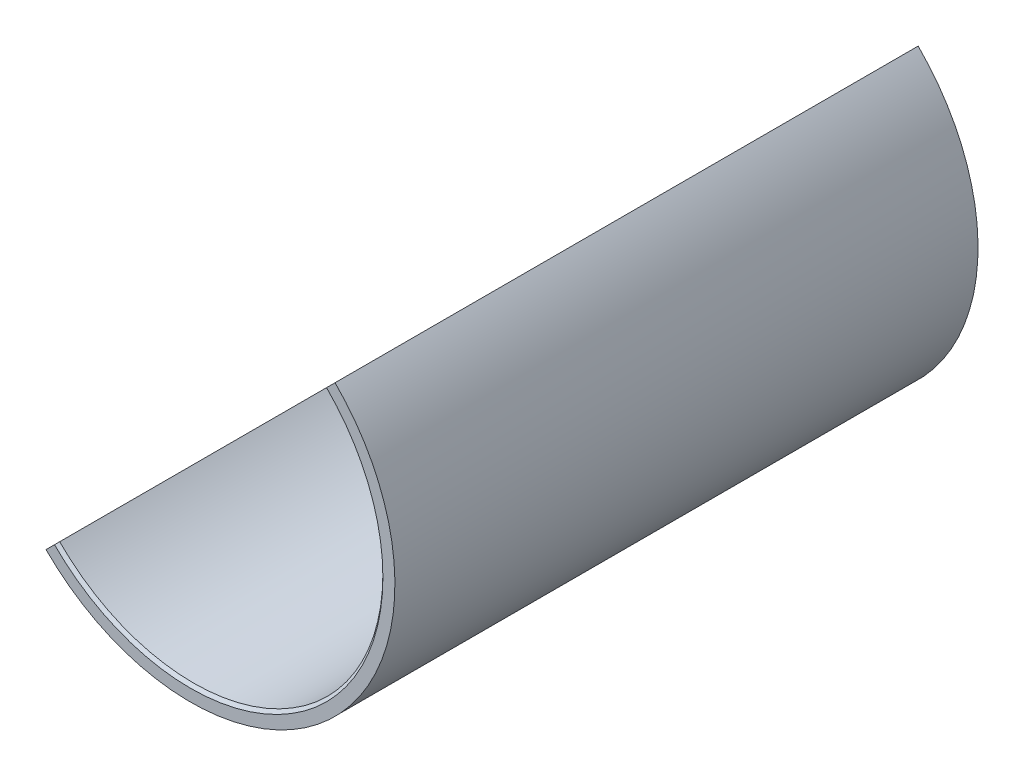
SolidWorks part; units mm, degrees
ref_plane "Plan1" through (0, 0, 0) normal (0, 0, 1) x (1, 0, 0)
ref_plane "Plan2" through (0, 0, 0) normal (0, 1, 0) x (1, 0, 0)
ref_plane "Plan3" through (0, 0, 0) normal (1, 0, 0) x (0, 0, -1)
sketch "Esquisse1" plane through (0, 0, 0) normal (0, 0, 1) x (1, 0, 0)
  circle A0 centre (0, 0) radius 31.5
  circle A1 centre (0, 0) radius 34
  dimension "D1" = 68
  dimension "D2" = 63
extrude "Base-Extrusion" add sketch "Esquisse1" against normal blind 97
chamfer "Chanfrein1" distance 0.5 angle 45
sketch "Esquisse3" plane through (0, 0, 0) normal (0, 0, 1) x (1, 0, 0)
  line L0 (30, 30) -> (-40, -40)
  line L1 (-40, -40) -> (-80, 0)
  line L2 (-80, 0) -> (-10, 70)
  line L3 (-10, 70) -> (30, 30)
extrude "Enlèv. mat.-Extru.1" cut sketch "Esquisse3" against normal through all
